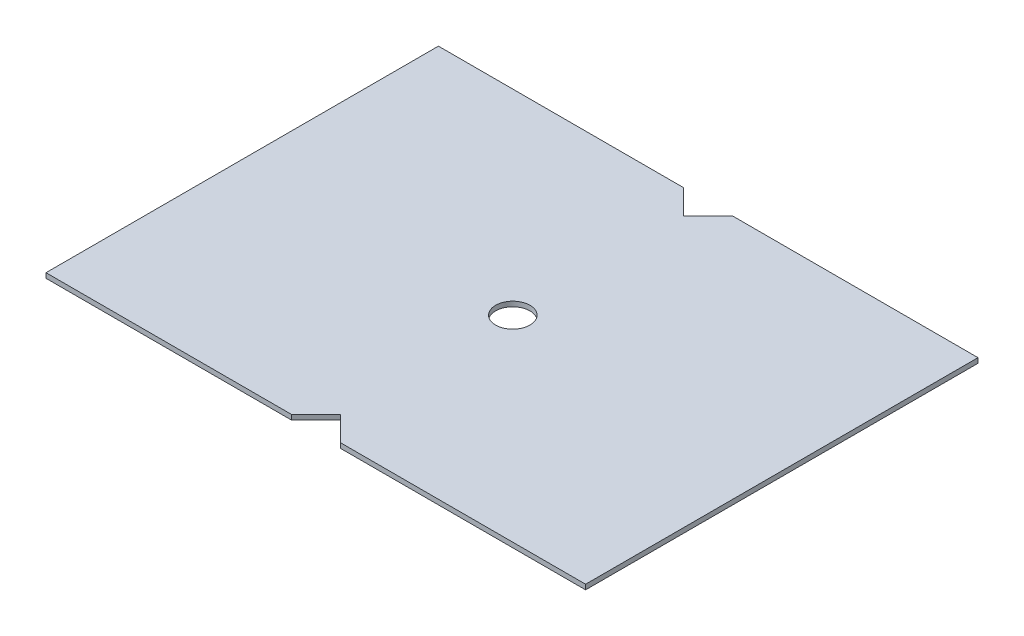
SolidWorks part; units mm, degrees
ref_plane "Plan de face" through (0, 0, 0) normal (0, 0, 1) x (1, 0, 0)
ref_plane "Plan de dessus" through (0, 0, 0) normal (0, 1, 0) x (1, 0, 0)
ref_plane "Plan de droite" through (0, 0, 0) normal (1, 0, 0) x (0, 0, -1)
sketch "Esquisse1" plane through (0, 0, 0) normal (0, 0, 1) x (1, 0, 0)
  line L1 (0, 0) -> (110, 0)
  line L2 (0, 0) -> (0, 1)
  line L3 (0, 1) -> (110, 1)
  line L4 (110, 0) -> (110, 1)
  dimension "D1" = 110
  dimension "D2" = 1
extrude "Extrusion1" add sketch "Esquisse1" against normal blind 80
sketch "Esquisse2" plane through (0, 1, 0) normal (0, 1, 0) x (-1, 0, 0)
  line L0 (1.8982, -40.0827) -> (-112.0636, -40.0827) construction
  line L1 (-55, -82.591) -> (-55, 5.072) construction
  circle A0 centre (-55.0827, -40.0827) radius 3.5
  dimension "D1" = 7
extrude "Enlèv. mat.-Extru.1" cut sketch "Esquisse2" against normal blind 1
sketch "Esquisse3" plane through (0, 1, 0) normal (0, 1, 0) x (-1, 0, 0)
  line L0 (0, -75) -> (-105.2822, -75) construction
  line L1 (0, -80) -> (0, 0) construction
  line L2 (0, -5) -> (-105.2822, -5) construction
  line L3 (-110, -80) -> (0, -80) construction
  line L4 (-110, 0) -> (0, 0) construction
  line L5 (-55, -80) -> (-55, 2.9218) construction
  line L6 (-55, -75) -> (-60, -80)
  line L7 (-55, -75) -> (-50, -80)
  line L8 (-50, -80) -> (-60, -80)
  line L9 (-55, -5) -> (-60, 0)
  line L10 (-55, -5) -> (-50, 0)
  line L11 (-50, 0) -> (-60, 0)
  dimension "D1" = 5
  dimension "D2" = 5
extrude "Enlèv. mat.-Extru.2" cut sketch "Esquisse3" against normal blind 1
